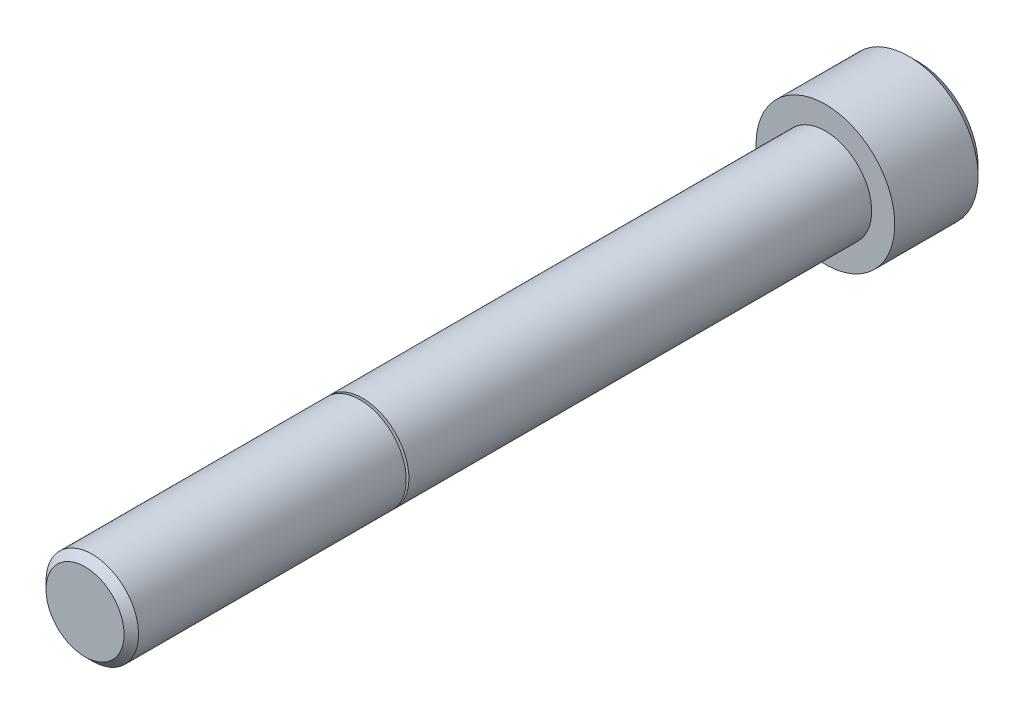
SolidWorks part; units mm, degrees
ref_plane "Front" through (0, 0, 0) normal (0, 0, 1) x (1, 0, 0)
ref_plane "Top" through (0, 0, 0) normal (0, 1, 0) x (1, 0, 0)
ref_plane "Right" through (0, 0, 0) normal (1, 0, 0) x (0, 0, -1)
sketch "Logo3_Revol_Axis" plane through (0, 0, 0) normal (0, 1, 0) x (1, 0, 0)
  line L0 (0, -43.5172) -> (0, 43.5172) construction
sketch "Logo3_bib1" plane through (0, 0, 0) normal (0, -1, 0) x (-1, 0, 0)
  line L0 (0, -101.6) -> (0, 12.7)
  line L1 (0, 12.7) -> (8.255, 12.7)
  line L2 (9.525, 11.43) -> (9.525, 0)
  line L3 (9.525, 0) -> (6.35, 0)
  line L4 (6.35, 0) -> (6.35, -63.51)
  line L5 (6.35, -100.6081) -> (5.3581, -101.6)
  line L6 (5.3581, -101.6) -> (0, -101.6)
  line L7 (6.35, -63.51) -> (5.4716, -63.51)
  line L8 (5.4647, -63.5488) -> (6.35, -63.871)
  line L9 (6.35, -63.871) -> (6.35, -100.6081)
  line L10 (0, 10.5852) -> (0, -63.2873) construction
  line L11 (8.255, 12.7) -> (9.525, 11.43)
  arc A1 (5.4716, -63.51) -> (5.4647, -63.5488) centre (5.4716, -63.53) ccw
  point P17 (5.3581, -63.51)
  point P19 (9.525, 12.7)
revolve "Revolve1" add sketch "Logo3_bib1" angle 360 about L10
sketch "Logo3_bib2" plane through (0, 0, -12.7) normal (0, 0, -1) x (1, 0, 0)
  line L1 (5.4993, 0) -> (2.7496, 4.7625)
  line L2 (2.7496, 4.7625) -> (-2.7496, 4.7625)
  line L3 (-2.7496, 4.7625) -> (-5.4993, 0)
  line L4 (-5.4993, 0) -> (-2.7496, -4.7625)
  line L5 (-2.7496, -4.7625) -> (2.7496, -4.7625)
  line L6 (2.7496, -4.7625) -> (5.4993, 0)
  circle A0 centre (0, 0) radius 4.7625 construction
  dimension "Logo3_c1" = 9.525
extrude "Cut-Extrude1" cut sketch "Logo3_bib2" against normal blind 6.35
equation "\"DIA2@Logo3_bib1\" = \"Logo3_d1-pas@Logo3_bib1\""
equation "\"LGT1@Logo3_bib1\" = \"Logo3_d1@Logo3_bib1\""
equation "\"D1@Cut-Extrude1\" = \"Logo3_d1@Logo3_bib1\"/2."
equation "\"D2@Cosmetic Thread1\" = \"Logo3_d1-pas@Logo3_bib1\""
equation "\"D5@Logo3_bib1\"=\"Logo3_d1@Logo3_bib1\"*.1"
